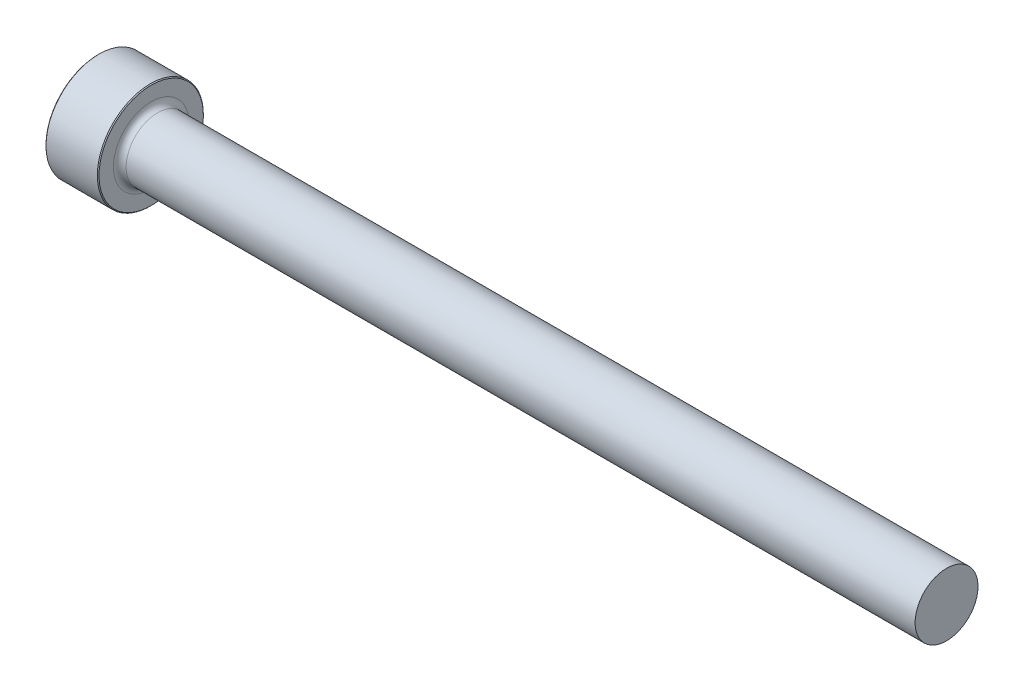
SolidWorks part; units mm, degrees
ref_plane "Front Plane" through (0, 0, 0) normal (0, 0, 1) x (1, 0, 0)
ref_plane "Top Plane" through (0, 0, 0) normal (0, 1, 0) x (1, 0, 0)
ref_plane "Right Plane" through (0, 0, 0) normal (1, 0, 0) x (0, 0, -1)
sketch "Sketch1" plane through (0, 0, 0) normal (0, 0, 1) x (1, 0, 0)
  line L0 (0, 0) -> (0, 6.35)
  line L1 (0, 6.35) -> (6.35, 6.35)
  line L2 (6.35, 6.35) -> (6.35, 4.5285)
  line L3 (7.112, 3.7665) -> (101.6, 3.7665)
  line L4 (101.6, 3.7665) -> (101.6, 0)
  line L5 (101.6, 0) -> (0, 0)
  line L6 (101.6, 0) -> (101.6, -3.7665) construction
  line L7 (101.6, -3.7665) -> (6.35, -3.7665) construction
  line L8 (0, 0) -> (0, -6.35) construction
  line L9 (0, -6.35) -> (6.35, -6.35) construction
  line L10 (6.35, -6.35) -> (6.35, -3.7665) construction
  arc A0 (6.35, 4.5285) -> (7.112, 3.7665) centre (7.112, 4.5285) ccw
  dimension "D4" = 0.762
  dimension "L" = 101.6
  dimension "D" = 7.533
  dimension "H" = 12.7
  dimension "T" = 6.35
revolve "Revolve1" add sketch "Sketch1" angle 360 about L5
chamfer "Chamfer1" distance 0.1016 angle 45 2 edges at (0, 6.35, 0) (6.35, 6.35, 0)
